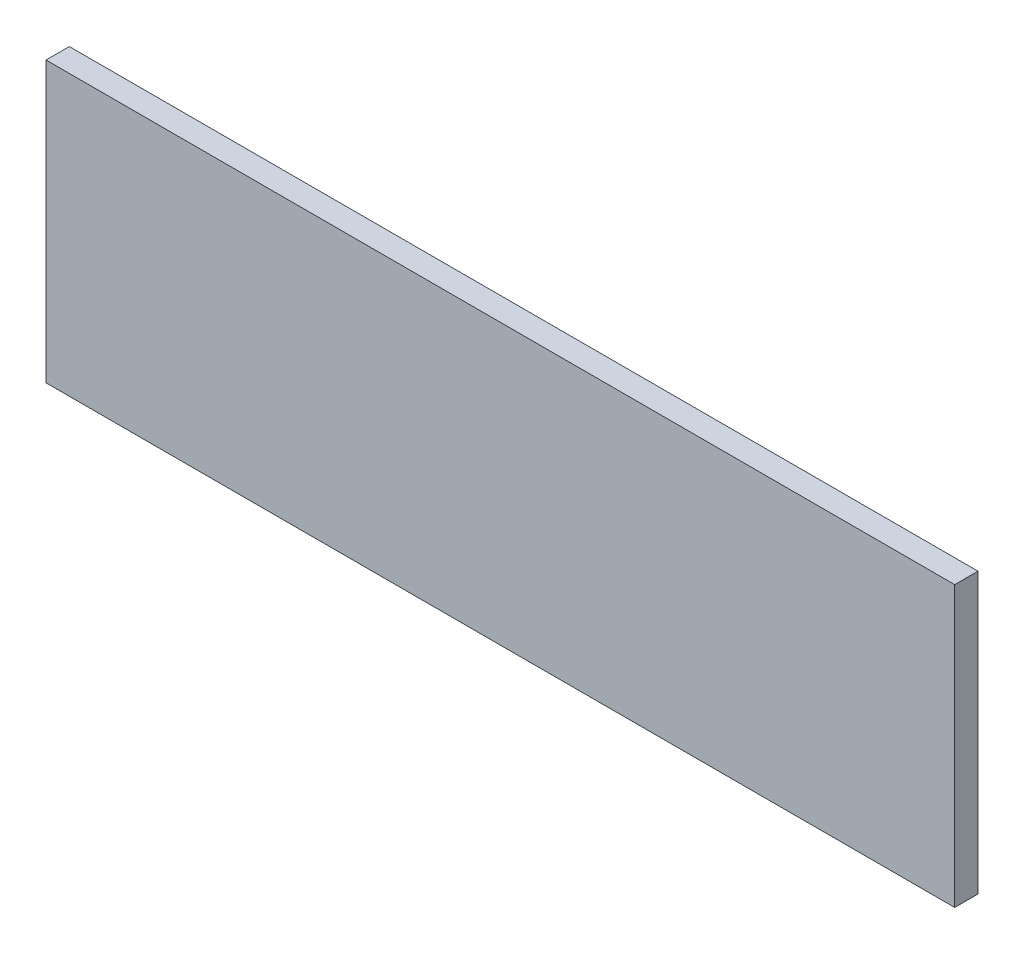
SolidWorks part; units mm, degrees
ref_plane "Front Plane" through (0, 0, 0) normal (0, 0, 1) x (1, 0, 0)
ref_plane "Top Plane" through (0, 0, 0) normal (0, 1, 0) x (1, 0, 0)
ref_plane "Right Plane" through (0, 0, 0) normal (1, 0, 0) x (0, 0, -1)
sketch "Sketch1" plane through (0, 0, 0) normal (0, 0, 1) x (1, 0, 0)
  line L1 (0, 0) -> (247.65, 0)
  line L2 (0, 0) -> (0, 76.2)
  line L3 (0, 76.2) -> (247.65, 76.2)
  line L4 (247.65, 0) -> (247.65, 76.2)
  dimension "D1" = 247.65
  dimension "D2" = 76.2
extrude "Boss-Extrude1" add sketch "Sketch1" along normal blind 6.35
